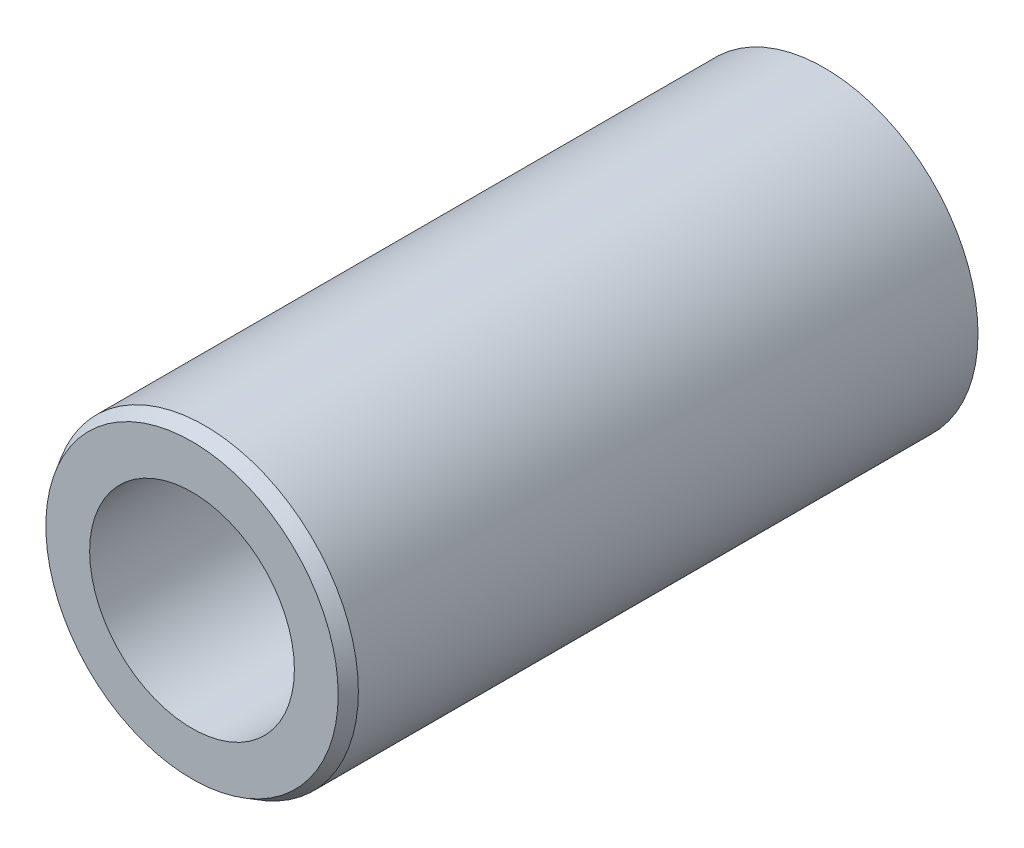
SolidWorks part; units mm, degrees
ref_plane "Plan de face" through (0, 0, 0) normal (0, 0, 1) x (1, 0, 0)
ref_plane "Plan de dessus" through (0, 0, 0) normal (0, 1, 0) x (1, 0, 0)
ref_plane "Plan de droite" through (0, 0, 0) normal (1, 0, 0) x (0, 0, -1)
sketch "Esquisse1" plane through (0, 0, 0) normal (0, 0, 1) x (1, 0, 0)
  circle A0 centre (0, 0) radius 4
  circle A1 centre (0, 0) radius 6
  dimension "D1" = 12
  dimension "D2" = 8
extrude "Boss.-Extru.1" add sketch "Esquisse1" along normal mid plane 25
chamfer "Chanfrein1" distance 0.5 angle 30 2 edges at (6, 0, -12.5) (6, 0, 12.5)
